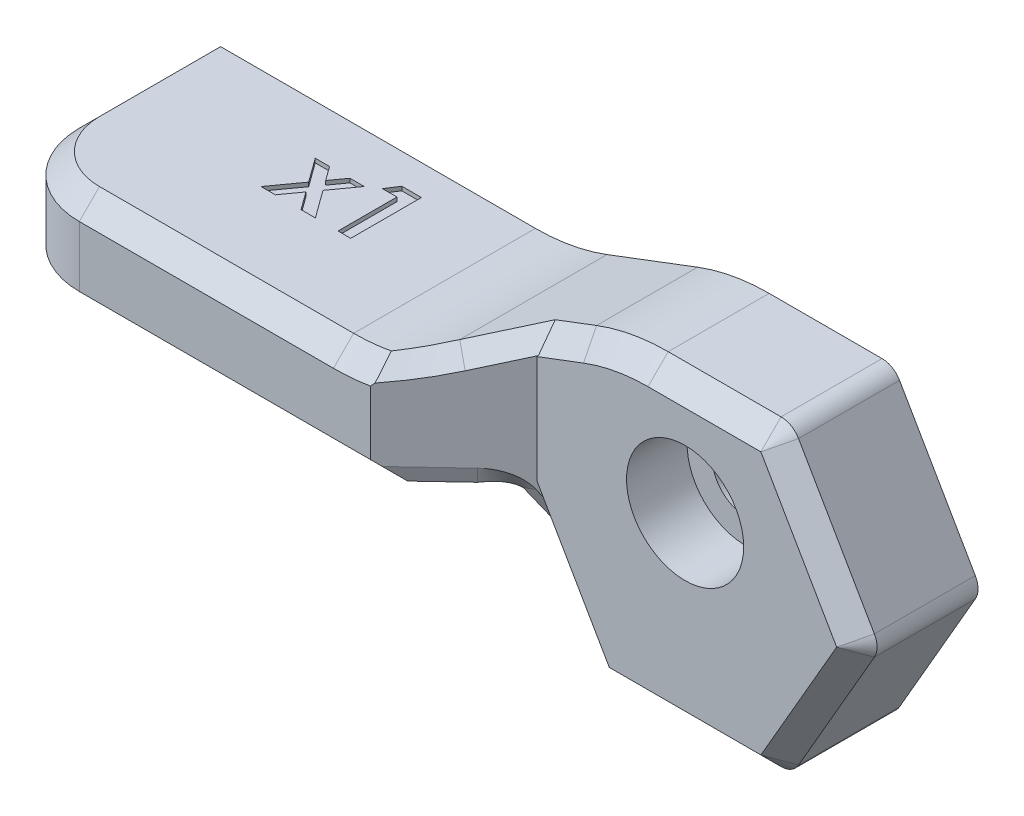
SolidWorks part; units mm, degrees
ref_plane "Спереди" through (0, 0, 0) normal (0, 0, 1) x (1, 0, 0)
ref_plane "Сверху" through (0, 0, 0) normal (0, 1, 0) x (1, 0, 0)
ref_plane "Справа" through (0, 0, 0) normal (1, 0, 0) x (0, 0, -1)
sketch "Эскиз1" plane through (0, 0, 0) normal (0, 0, 1) x (1, 0, 0)
  line L0 (0, 5.9013) -> (0, 0) construction
  line L1 (0, 0) -> (7.6127, 0) construction
  line L2 (-30, 4.5) -> (-11.58, 4.5)
  line L3 (8.6603, 0) -> (4.3301, 7.5)
  line L4 (4.3301, 7.5) -> (-3.6699, 7.5)
  line L5 (-11.58, 4.5) -> (-3.6699, 7.5)
  line L6 (-8.3716, -0.5) -> (-4.3301, -7.5)
  line L7 (-4.3301, -7.5) -> (4.3301, -7.5)
  line L8 (4.3301, -7.5) -> (8.6603, 0)
  line L9 (-30, 4.5) -> (-30, -0.5)
  line L10 (-30, -0.5) -> (-8.3716, -0.5)
  line L12 (-6.4952, 3.75) -> (-8.8046, -0.25)
  circle A0 centre (0, 0) radius 1.5 construction
  circle A1 centre (0, 0) radius 7.5 construction
  dimension "D1" = 3
  dimension "D2" = 15
  dimension "D5" = 8
  dimension "D3" = 30
  dimension "D4" = 5
  dimension "D6" = 3
extrude "Бобышка-Вытянуть1" add sketch "Эскиз1" along normal blind 10
fillet "Скругление1" radius 1 1 edges at (-8.3716, -0.5, 5)
fillet "Скругление2" radius 1 4 edges at (-4.3301, -7.5, 5) (4.3301, -7.5, 5) (8.6603, 0, 5) (4.3301, 7.5, 5)
sketch "Эскиз8" plane through (0, 7.5, 0) normal (0, 1, 0) x (1, 0, 0)
  line L0 (-11.58, -10) -> (-7.3266, -6)
  line L1 (-7.3266, -6) -> (8.5056, -6)
  line L3 (8.5056, -6) -> (8.5056, -10)
  line L4 (8.5056, -10) -> (-11.58, -10)
  dimension "D1" = 6
extrude "Вырез-Вытянуть6" cut sketch "Эскиз8" against normal through all
sketch "Эскиз3" plane through (0, 0, 10) normal (0, 0, 1) x (1, 0, 0)
  line L0 (0, 0) -> (0, -7.5) construction
  line L2 (-3.7528, -7.5) -> (3.7528, -7.5) construction
  circle A0 centre (0, 2) radius 1.65
  dimension "D1" = 3.3
  dimension "D2" = 2
extrude "Вырез-Вытянуть2" cut sketch "Эскиз3" against normal through all
sketch "Эскиз6" plane through (0, 0, 6) normal (0, 0, 1) x (1, 0, 0)
  circle A0 centre (0, 2) radius 2.9
  dimension "D1" = 5.8
extrude "Вырез-Вытянуть5" cut sketch "Эскиз6" against normal blind 3
fillet "Скругление3" radius 10 2 edges at (-11.58, 4.5, 5) (-3.6699, 7.5, 3)
fillet "Скругление4" radius 4 1 edges at (-30, 2, 10)
chamfer "Фаска1" distance 1 angle 45 23 edges at (-6.355, 6.4816, 6) (-19.7063, 4.5, 10) (-8.5965, 5.6315, 7.1943) (-10.7125, 4.8714, 9.1842) (-5.9727, -4.655, 6) (-4.2528, -7.366, 6) (0, -7.5, 6) (4.2528, -7.366, 6) (6.4952, -3.75, 6) (8.5056, 0, 6) (6.4952, 3.75, 6) (4.2528, 7.366, 6) (0.9578, 7.5, 6) (-3.6399, 7.3362, 6) (-30, -0.5, 3) (-28.8284, -0.5, 8.8284) (-18.79, -0.5, 10) (-10.2645, -0.5, 8.7628) (-8.4489, -0.634, 7.0555) (-7.7047, -1.655, 6.3556) (-30, 4.5, 3) (-28.8284, 4.5, 8.8284) (-12.4924, 4.5424, 10)
sketch "Эскиз9" plane through (0, 4.5, 0) normal (0, 1, 0) x (1, 0, 0)
  line L0 (-13.4126, 0) -> (-29, 0) construction
  line L1 (-30, -6) -> (-30, 0) construction
  text T0 "<b>x1</b>"
  dimension "D1" = 5
  dimension "D2" = 8
extrude "Вырез-Вытянуть7" cut sketch "Эскиз9" against normal blind 0.2
